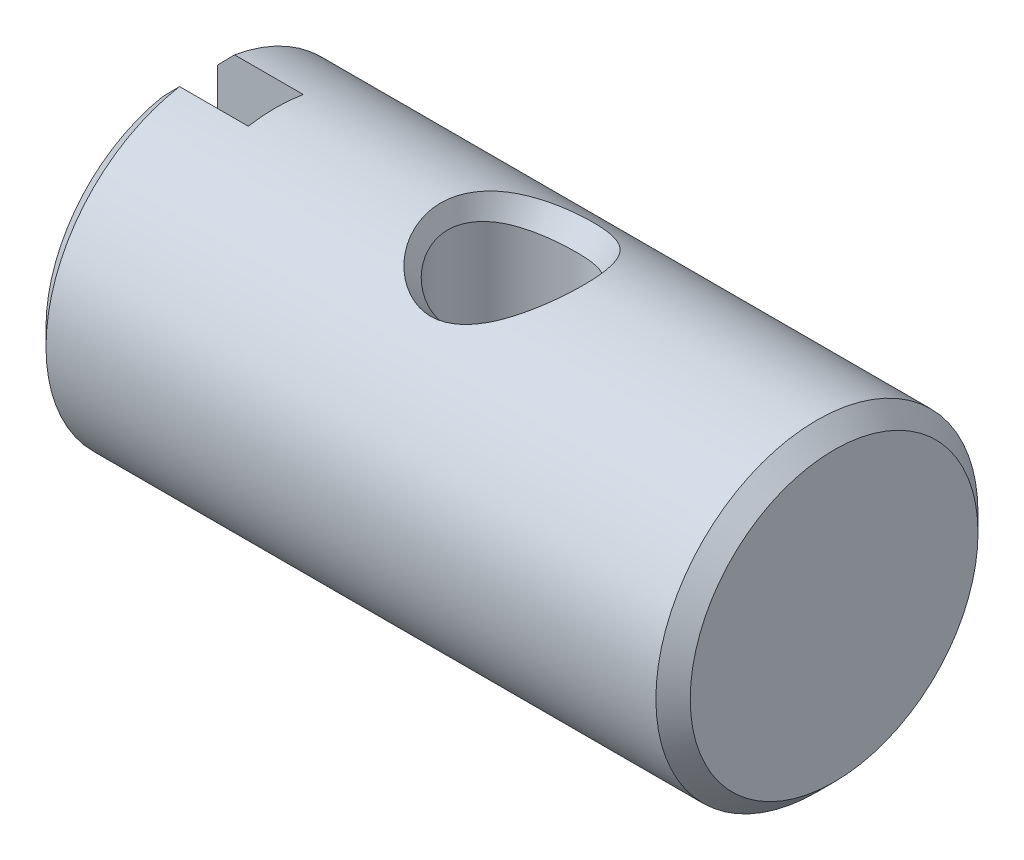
SolidWorks part; units mm, degrees
ref_plane "Front Plane" through (0, 0, 0) normal (0, 0, 1) x (1, 0, 0)
ref_plane "Top Plane" through (0, 0, 0) normal (0, 1, 0) x (1, 0, 0)
ref_plane "Right Plane" through (0, 0, 0) normal (1, 0, 0) x (0, 0, -1)
sketch "Sketch1" plane through (0, 0, 0) normal (1, 0, 0) x (0, 0, -1)
  circle A0 centre (0, 0) radius 4.7625
  dimension "D1" = 9.525
extrude "Boss-Extrude1" add sketch "Sketch1" along normal blind 19.05
chamfer "Chamfer1" distance 0.508 angle 45
sketch "Sketch2" plane through (0, 0, 0) normal (-1, 0, 0) x (0, 0, 1)
  line L0 (0, 0) -> (0, 5.1985) construction
  line L1 (-0.8128, 4.9434) -> (-0.8128, -5.0789)
  line L2 (-0.8128, 4.9434) -> (0.8128, 4.9434)
  line L4 (-0.8128, -5.0789) -> (0.8128, -5.0789)
  line L5 (0.8128, 4.9434) -> (0.8128, -5.0789)
extrude "Cut-Extrude1" cut sketch "Sketch2" against normal blind 2.54
sketch "Sketch3" plane through (0, 0, 0) normal (0, 1, 0) x (1, 0, 0)
  line L0 (9.525, 4.7625) -> (9.525, -4.7625) construction
  line L1 (18.542, 4.7625) -> (0.508, 4.7625) construction
  line L2 (0.508, -4.7625) -> (18.542, -4.7625) construction
ref_plane "Plane1" through (0, 4.7625, 0) normal (0, 1, 0) x (-1, 0, 0)
hole_wizard "#10-24 Tapped Hole1" positions "Sketch5" profile "Sketch4" tap size "#10-24" standard "Ansi Inch"
sketch "Sketch5" plane through (-107.657, 4.7625, 48.4223) normal (0, 1, 0) x (1, 0, 0)
  line L0 (117.182, 53.1848) -> (117.182, 43.6598) construction
  point P1 (117.182, 48.4223)
sketch "Sketch4" plane through (9.525, 4.7625, 0) normal (1, 0, 0) x (0, 0, 1)
  line L0 (0, 0) -> (0, 13.5868)
  line L1 (0, 13.5868) -> (1.8986, 12.446)
  line L2 (1.8986, 12.446) -> (1.8986, 0)
  line L5 (1.8986, 0) -> (0, 0)
  line L10 (0, 13.5868) -> (-1.8987, 12.446) construction
  line L11 (0, -6.35) -> (0, 107.95) construction
  dimension "Tap Drill Dia." = 3.7973
  dimension "Tap Drill Depth" = 12.446
  dimension "Drill Angle" = 118
chamfer "Chamfer2" distance 0.762 angle 45
